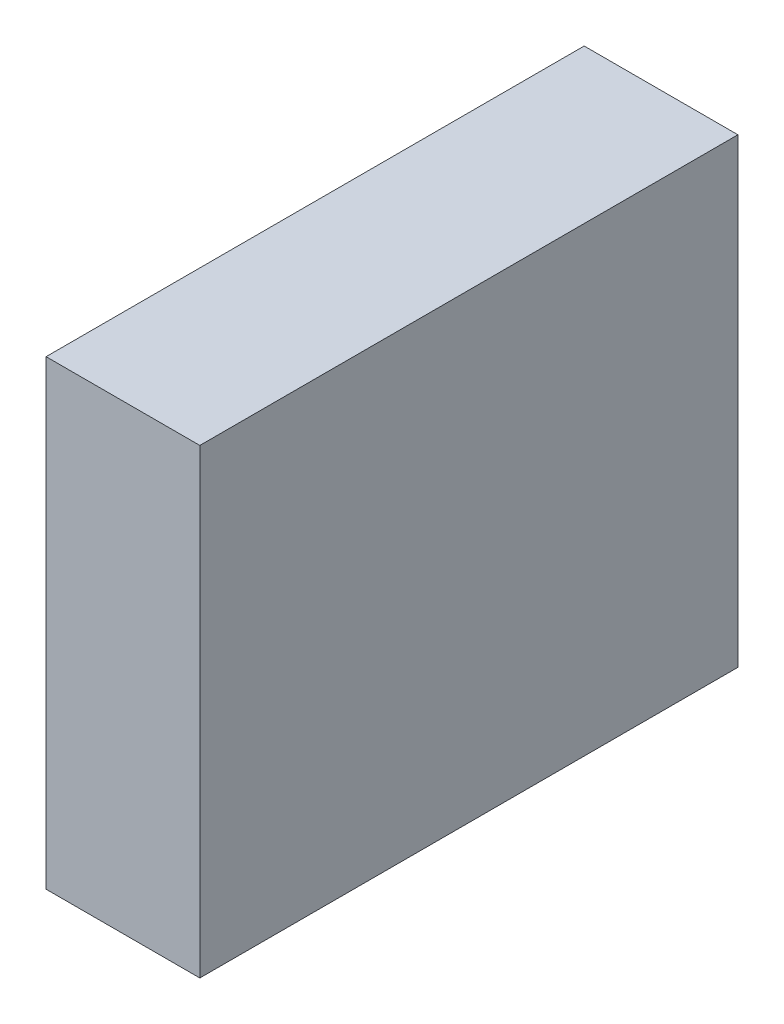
SolidWorks part; units mm, degrees
ref_plane "Front Plane" through (0, 0, 0) normal (0, 0, 1) x (1, 0, 0)
ref_plane "Top Plane" through (0, 0, 0) normal (0, 1, 0) x (1, 0, 0)
ref_plane "Right Plane" through (0, 0, 0) normal (1, 0, 0) x (0, 0, -1)
sketch "Sketch1" plane through (0, 0, 0) normal (1, 0, 0) x (0, 0, -1)
  line L0 (0, 0) -> (44.45, 0)
  line L1 (0, 0) -> (0, 38.1)
  line L2 (44.45, 0) -> (44.45, 38.1)
  line L3 (0, 38.1) -> (44.45, 38.1)
  dimension "D1" = 44.45
  dimension "D2" = 38.1
extrude "Boss-Extrude1" add sketch "Sketch1" along normal blind 12.7
